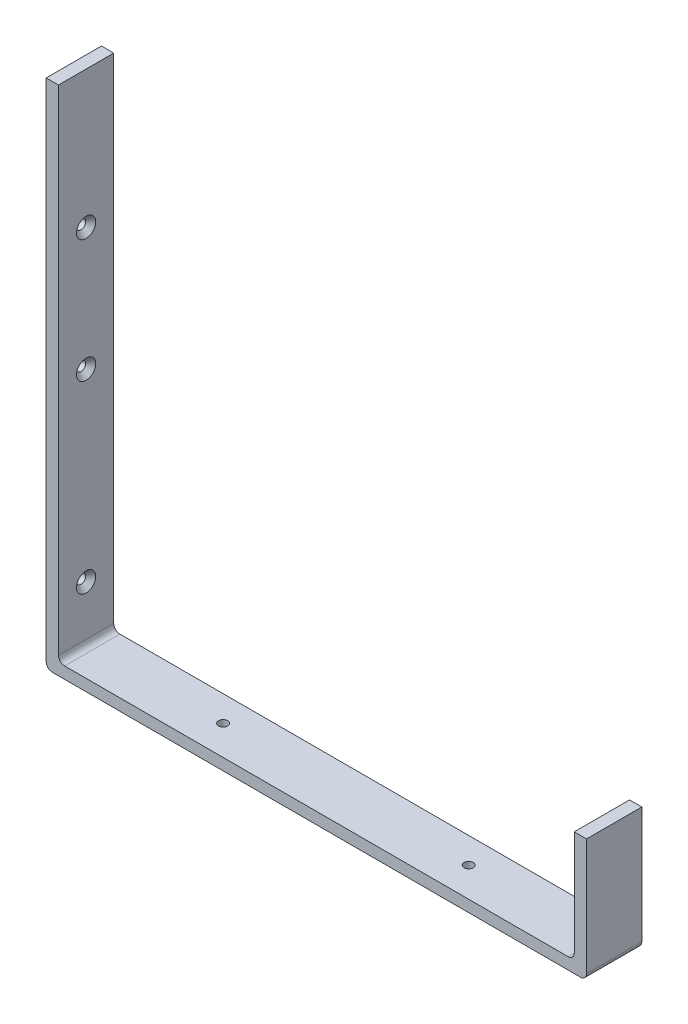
SolidWorks part; units mm, degrees
ref_plane "Front Plane" through (0, 0, 0) normal (0, 0, 1) x (1, 0, 0)
ref_plane "Top Plane" through (0, 0, 0) normal (0, 1, 0) x (1, 0, 0)
ref_plane "Right Plane" through (0, 0, 0) normal (1, 0, 0) x (0, 0, -1)
sketch "Sketch1" plane through (0, 0, 0) normal (0, 0, 1) x (1, 0, 0)
  line L0 (132, -125) -> (132, -65)
  line L1 (132, -125) -> (-132, -125)
  line L2 (132, -125) -> (132, 125) construction
  line L3 (132, 125) -> (-132, 125) construction
  line L4 (-132, -125) -> (-132, 125)
  line L5 (132, -125) -> (-132, 125) construction
  line L6 (132, 125) -> (-132, -125) construction
  line L7 (-132, 125) -> (-126, 125)
  line L8 (-126, 125) -> (-126, -119.3182)
  line L9 (-126, -119.3182) -> (126, -119.3182)
  line L10 (126, -119.3182) -> (126, -65)
  line L11 (126, -65) -> (132, -65)
  point P0 (0, 0)
  dimension "D1" = 250
  dimension "D2" = 264
  dimension "D3" = 60
  dimension "D4" = 6
  dimension "D5" = 6
extrude "Boss-Extrude1" add sketch "Sketch1" along normal blind 27
fillet "Fillet1" radius 3 2 edges at (-132, -125, 13.5) (132, -125, 13.5)
fillet "Fillet2" radius 3 2 edges at (126, -119.3182, 13.5) (-126, -119.3182, 13.5)
hole_wizard "CSK for M4 Flat Head Machine Screw1" positions "Sketch2" profile "Sketch3" countersink size "M4" standard "ANSI Metric"
sketch "Sketch2" plane through (0, -125, 0) normal (0, -1, 0) x (-1, 0, 0)
  line L0 (-132, -27) -> (-132, 0) construction
  point P0 (60, -12.5721)
  point P2 (-60, -12.5721)
  dimension "D1" = 72
  dimension "D2" = 192
sketch "Sketch3" plane through (-60, -125, 12.5721) normal (1, 0, 0) x (0, 0, -1)
  line L0 (0, 0) -> (0, 250)
  line L1 (0, 250) -> (2.25, 250)
  line L2 (2.25, 250) -> (2.25, 2.45)
  line L3 (2.25, 2.45) -> (4.7, 0)
  line L5 (4.7, 0) -> (0, 0)
  line L6 (-2.25, 2.45) -> (-4.7, 0) construction
  line L11 (0, -6.35) -> (0, 107.95) construction
  dimension "Thru Hole Dia." = 4.5
  dimension "Thru Hole Depth" = 250
  dimension "Near C'Sink Dia." = 9.4
  dimension "Near C'Sink Angle" = 90
hole_wizard "CSK for M4 Flat Head Machine Screw2" positions "Sketch4" profile "Sketch5" countersink size "M4" standard "ANSI Metric"
sketch "Sketch4" plane through (-126, 0, 0) normal (1, 0, 0) x (0, 0, -1)
  line L1 (-27, -125) -> (0, -125) construction
  line L2 (-27, 125) -> (0, 125) construction
  point P0 (-13.5, -92)
  point P2 (-13.5, 58)
  point P4 (-13.5, -2)
  point P11 (0, 0)
  point P14 (-13.5, 125)
  point P15 (0, 0)
  point P16 (0, 0)
  dimension "D1" = 33
  dimension "D2" = 183
  dimension "D3" = 123
sketch "Sketch5" plane through (-126, -92, 13.5) normal (0, 1, 0) x (0, 0, -1)
  line L0 (0, 0) -> (0, 6)
  line L1 (0, 6) -> (2.25, 6)
  line L2 (2.25, 6) -> (2.25, 2.45)
  line L3 (2.25, 2.45) -> (4.7, 0)
  line L5 (4.7, 0) -> (0, 0)
  line L6 (-2.25, 2.45) -> (-4.7, 0) construction
  line L11 (0, -6.35) -> (0, 107.95) construction
  dimension "Thru Hole Dia." = 4.5
  dimension "Thru Hole Depth" = 6
  dimension "Near C'Sink Dia." = 9.4
  dimension "Near C'Sink Angle" = 90
